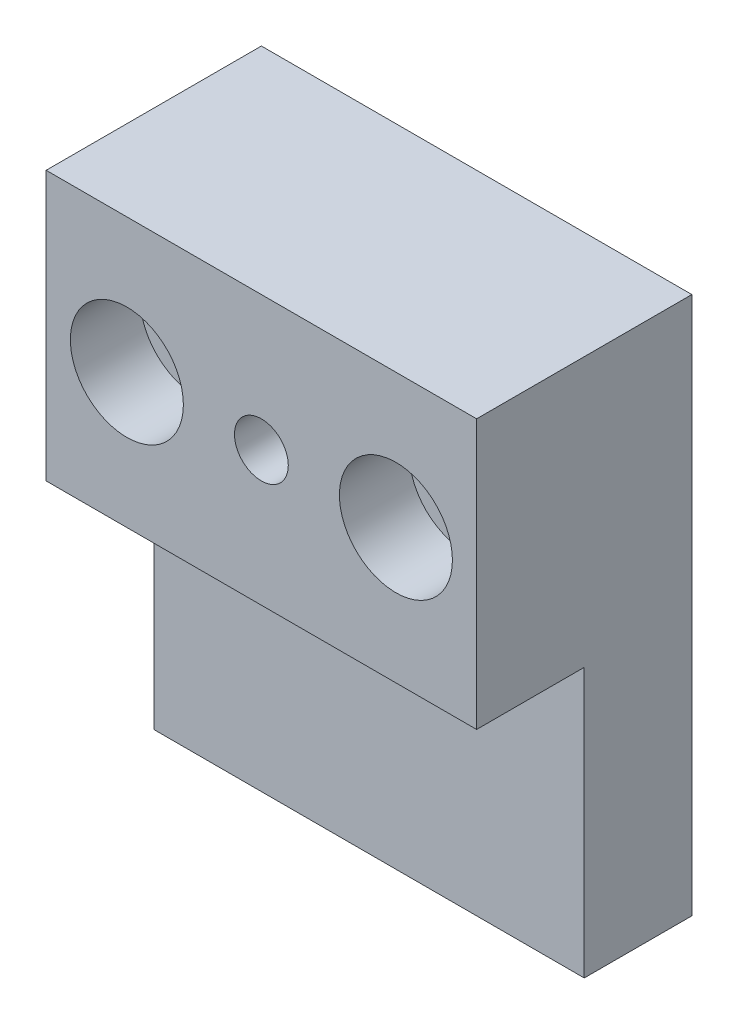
SolidWorks part; units mm, degrees
ref_plane "Plan de face" through (0, 0, 0) normal (0, 0, 1) x (1, 0, 0)
ref_plane "Plan de dessus" through (0, 0, 0) normal (0, 1, 0) x (1, 0, 0)
ref_plane "Plan de droite" through (0, 0, 0) normal (1, 0, 0) x (0, 0, -1)
sketch "Esquisse1" plane through (0, 0, 0) normal (0, 0, 1) x (1, 0, 0)
  line L1 (0, 0) -> (40, 0)
  line L2 (0, 0) -> (0, 50)
  line L3 (0, 50) -> (40, 50)
  line L4 (40, 0) -> (40, 50)
  dimension "D1" = 40
  dimension "D2" = 50
extrude "Extrusion1" add sketch "Esquisse1" along normal blind 20
sketch "Esquisse3" plane through (0, 0, 20) normal (0, 0, 1) x (1, 0, 0)
  line L0 (40, 0) -> (40, 50) construction
  line L1 (0, 0) -> (40, 0)
  line L2 (0, 0) -> (0, 25)
  line L3 (0, 25) -> (40, 25)
  line L4 (40, 0) -> (40, 25)
  dimension "D1" = 25
extrude "Enlèv. mat.-Extru.1" cut sketch "Esquisse3" against normal blind 10
hole_wizard "Perçage1" positions "Esquisse5" profile "Esquisse4" legacy
sketch "Esquisse5" plane through (0, 0, 20) normal (0, 0, 1) x (1, 0, 0)
  line L0 (40, 50) -> (0, 50) construction
  line L1 (0, 50) -> (0, 25) construction
  point P0 (7.5, 37.5)
  point P6 (32.5, 37.5)
  dimension "D1" = 12.5
  dimension "D2" = 7.5
  dimension "D3" = 25
sketch "Esquisse4" plane through (7.5, 37.5, 20) normal (1, 0, 0) x (0, -1, 0)
  line L0 (0, 0) -> (0, 26.9528)
  line L1 (0, 26.9528) -> (3.25, 25)
  line L2 (3.25, 25) -> (3.25, 6.5)
  line L3 (3.25, 6.5) -> (5.25, 6.5)
  line L4 (5.25, 0) -> (0, 0)
  line L5 (0, -11.3109) -> (0, 121.1557) construction
  line L6 (0, 26.9528) -> (-3.25, 25) construction
  line L7 (5.25, 6.5) -> (5.25, 0)
  dimension "Diamètre" = 6.5
  dimension "Profondeur" = 25
  dimension "Diamètre chambrage" = 10.5
  dimension "Profondeur chambrage" = 6.5
  dimension "Angle" = 118
hole_wizard "Trou taraudé M61" positions "Esquisse3D1" profile "Esquisse6" tap size "M6" standard "ISO"
sketch3d "Esquisse3D1"
  line L0 (40, 50, 20) -> (0, 50, 20) construction
  line L1 (0, 50, 20) -> (0, 25, 20) construction
  point P0 (20, 37.5, 20)
  dimension "D1" = 12.5
  dimension "D2" = 20
sketch "Esquisse6" plane through (20, 37.5, 20) normal (1, 0, 0) x (0, -1, 0)
  line L0 (0, 0) -> (0, 20)
  line L1 (0, 20) -> (2.5, 20)
  line L2 (2.5, 20) -> (2.5, 0)
  line L5 (2.5, 0) -> (0, 0)
  line L11 (0, -6.35) -> (0, 107.95) construction
  dimension "Diamètre du trou pour taraudage jusqu'au prochain" = 5
  dimension "Profondeur du trou pour taraudage jusqu'au prochain" = 20
sketch "Esquisse7" plane through (0, 0, 0) normal (0, 0, -1) x (-1, 0, 0)
  circle A0 centre (-32.5, 37.5) radius 6
  dimension "D1" = 12
extrude "Enlèv. mat.-Extru.2" cut sketch "Esquisse7" against normal blind 5
sketch "Esquisse8" plane through (0, 0, 0) normal (0, 0, -1) x (-1, 0, 0)
  circle A0 centre (-7.5, 37.5) radius 6
  dimension "D1" = 12
extrude "Enlèv. mat.-Extru.3" cut sketch "Esquisse8" against normal blind 5
